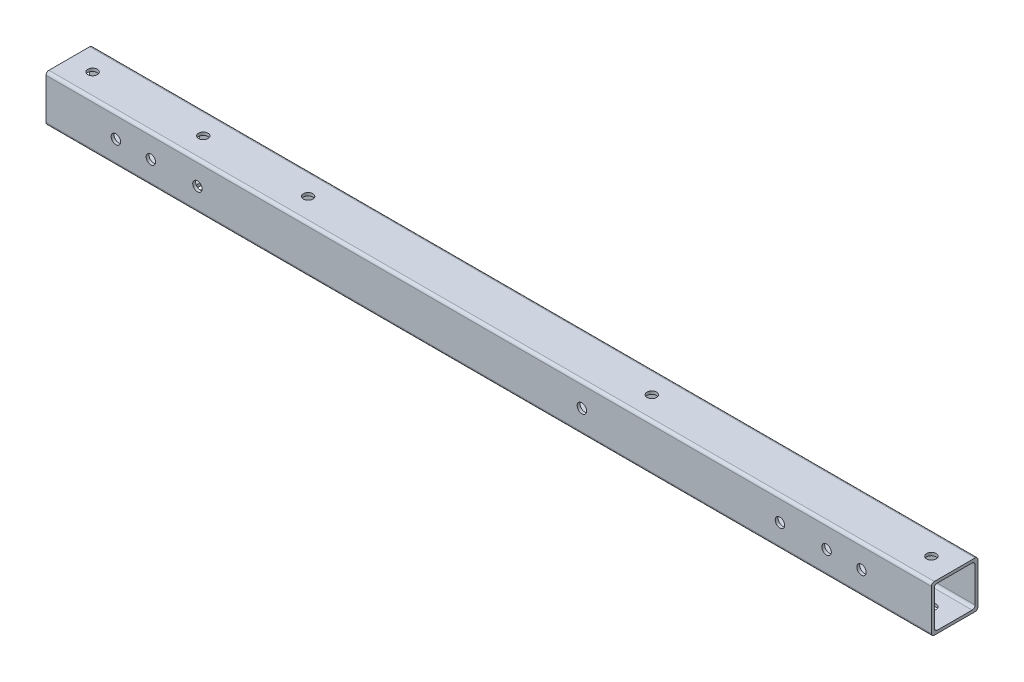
SolidWorks part; units mm, degrees
ref_plane "Front Plane" through (0, 0, 0) normal (0, 0, 1) x (1, 0, 0)
ref_plane "Top Plane" through (0, 0, 0) normal (0, 1, 0) x (1, 0, 0)
ref_plane "Right Plane" through (0, 0, 0) normal (1, 0, 0) x (0, 0, -1)
sketch "Sketch1" plane through (0, 0, 0) normal (0, 1, 0) x (1, 0, 0)
  line L1 (0, 0) -> (-1930.4, 0)
  line L2 (0, 0) -> (0, -101.6)
  line L3 (0, -101.6) -> (-1930.4, -101.6)
  line L4 (-1930.4, 0) -> (-1930.4, -101.6)
  dimension "D1" = 1930.4
  dimension "D2" = 101.6
extrude "Extrude1" add sketch "Sketch1" along normal blind 101.6
sketch "Sketch2" plane through (-1930.4, 0, 0) normal (-1, 0, 0) x (0, 0, 1)
  line L0 (0, 101.6) -> (101.6, 101.6) construction
  line L1 (6.35, 95.25) -> (95.25, 95.25)
  line L2 (6.35, 95.25) -> (6.35, 6.35)
  line L3 (6.35, 6.35) -> (95.25, 6.35)
  line L4 (95.25, 95.25) -> (95.25, 6.35)
  line L5 (0, 0) -> (101.6, 0) construction
  line L6 (101.6, 101.6) -> (101.6, 0) construction
  line L7 (0, 101.6) -> (0, 0) construction
  dimension "D1" = 6.35
  dimension "D2" = 6.35
  dimension "D3" = 6.35
  dimension "D4" = 6.35
extrude "Cut-Extrude1" cut sketch "Sketch2" against normal up to next
sketch "Sketch3" plane through (0, 101.6, 0) normal (0, 1, 0) x (1, 0, 0)
  line L0 (0, -101.6) -> (0, 0) construction
  line L1 (0, 0) -> (-1930.4, 0) construction
  circle A0 centre (-1879.6, -50.8) radius 10.3188
  dimension "D1" = 20.6375
  dimension "D2" = 1879.6
  dimension "D3" = 50.8
extrude "Cut-Extrude2" cut sketch "Sketch3" against normal through all
fillet "Fillet1" radius 6.35 8 edges at (-965.2, 6.35, 95.25) (-965.2, 0, 101.6) (-965.2, 101.6, 101.6) (-965.2, 95.25, 95.25) (-965.2, 95.25, 6.35) (-965.2, 101.6, 0) (-965.2, 6.35, 6.35) (-965.2, 0, 0)
sketch "Sketch4" plane through (0, 0, 0) normal (0, 0, 1) x (1, 0, 0)
  circle A0 centre (-1778, 50.8) radius 10.3188
  dimension "D1" = 20.6375
  dimension "D2" = 1778
  dimension "D3" = 50.8
extrude "Cut-Extrude3" cut sketch "Sketch4" along normal blind 101.6
sketch "Sketch5" plane through (0, 0, 0) normal (0, 0, -1) x (-1, 0, 0)
  line L0 (0, 95.25) -> (0, 6.35) construction
  line L1 (0, 6.35) -> (1930.4, 6.35) construction
  circle A0 centre (1701.8, 50.8) radius 10.3188
  circle A1 centre (1600.2, 50.8) radius 10.3188
  dimension "D1" = 20.6375
  dimension "D2" = 1600.2
  dimension "D3" = 1701.8
  dimension "D4" = 44.45
extrude "Cut-Extrude4" cut sketch "Sketch5" against normal blind 101.6
ref_plane "Plane1" through (-965.2, 0, 0) normal (1, 0, 0) x (0, 0, -1)
mirror "Mirror1" about plane through (-965.2, 0, 0) normal (1, 0, 0) of "Cut-Extrude4", "Cut-Extrude3", "Cut-Extrude2"
sketch "Sketch6" plane through (0, 101.6, 0) normal (0, 1, 0) x (1, 0, 0)
  line L0 (-1930.4, -6.35) -> (-1930.4, -95.25) construction
  line L1 (0, -6.35) -> (-1930.4, -6.35) construction
  circle A0 centre (-660.4, -50.8) radius 10.3188
  dimension "D1" = 20.6375
  dimension "D2" = 1270
  dimension "D3" = 44.45
extrude "Cut-Extrude5" cut sketch "Sketch6" against normal blind 101.6
sketch "Sketch7" plane through (0, 0, 0) normal (0, 0, -1) x (-1, 0, 0)
  line L0 (1930.4, 95.25) -> (1930.4, 6.35) construction
  line L1 (1930.4, 95.25) -> (0, 95.25) construction
  circle A0 centre (762, 50.8) radius 10.3188
  dimension "D1" = 20.6375
  dimension "D2" = 1168.4
  dimension "D3" = 44.45
extrude "Cut-Extrude6" cut sketch "Sketch7" against normal blind 101.6
sketch "Sketch8" plane through (0, 101.6, 0) normal (0, 1, 0) x (1, 0, 0)
  line L0 (-1930.4, -6.35) -> (-1930.4, -95.25) construction
  line L1 (0, -6.35) -> (-1930.4, -6.35) construction
  line L2 (0, -95.25) -> (0, -6.35) construction
  circle A0 centre (-1409.7, -50.8) radius 10.3188
  dimension "D1" = 20.6375
  dimension "D2" = 1409.7
  dimension "D3" = 44.45
extrude "Cut-Extrude7" cut sketch "Sketch8" against normal blind 101.6
sketch "Sketch10" plane through (0, 101.6, 0) normal (0, 1, 0) x (1, 0, 0)
  line L0 (-1930.4, -6.35) -> (-1930.4, -95.25) construction
  line L1 (0, -6.35) -> (-1930.4, -6.35) construction
  circle A0 centre (-1638.3, -50.8) radius 10.3188
  dimension "D1" = 20.6375
  dimension "D2" = 292.1
  dimension "D3" = 44.45
extrude "Cut-Extrude8" cut sketch "Sketch10" against normal through all
